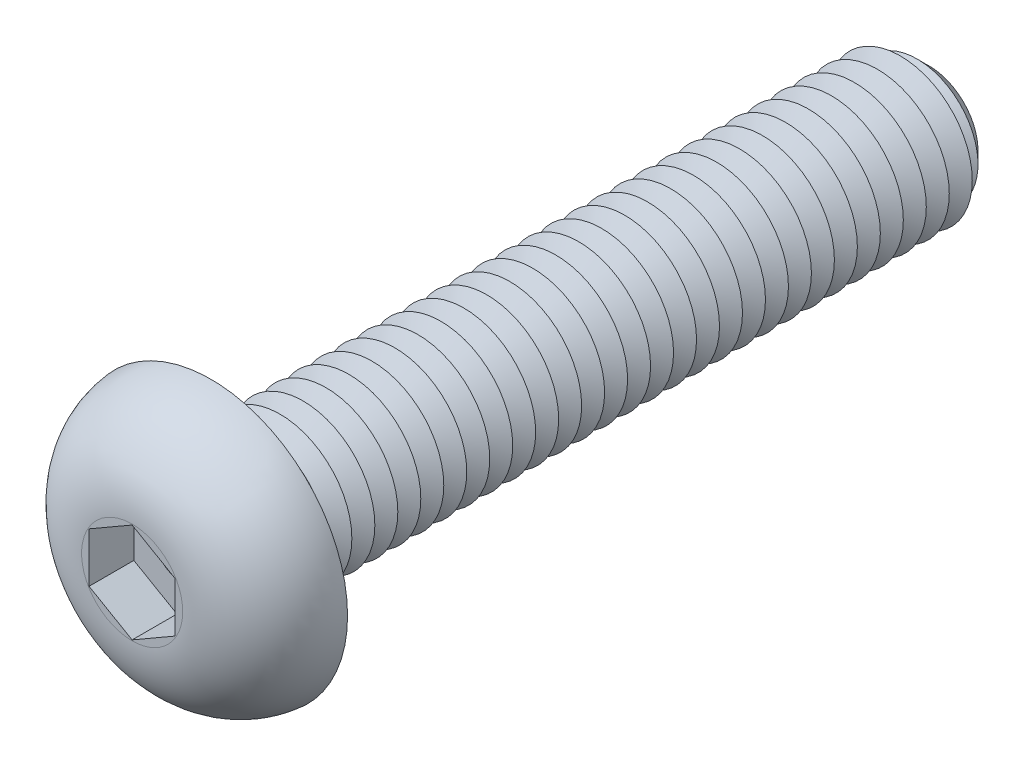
SolidWorks part; units mm, degrees
ref_plane "Front Plane" through (0, 0, 0) normal (0, 0, 1) x (1, 0, 0)
ref_plane "Top Plane" through (0, 0, 0) normal (0, 1, 0) x (1, 0, 0)
ref_plane "Right Plane" through (0, 0, 0) normal (1, 0, 0) x (0, 0, -1)
sketch "Sketch1" plane through (0, 0, 0) normal (1, 0, 0) x (0, 0, -1)
  line L0 (-47.9342, 0) -> (60.3146, 0) construction
sketch "Sketch2" plane through (0, 0, 0) normal (1, 0, 0) x (0, 0, -1)
  line L0 (0, 0) -> (-2.75, 0)
  line L1 (-47.9342, 0) -> (60.3146, 0) construction
  line L2 (-2.75, 0) -> (-2.75, 1.7604)
  line L3 (0, 4.75) -> (0, 0)
  arc A0 (-2.75, 1.7604) -> (0, 4.75) centre (0.25, 1.7604) cw
  dimension "D1" = 3
  dimension "D2" = 2.75
  dimension "D3" = 4.75
revolve "Revolve1" add sketch "Sketch2" angle 360 about L0
sketch "Sketch3" plane through (0, 0, 2.75) normal (0, 0, 1) x (1, 0, 0)
  line L1 (0, 1.7321) -> (-1.5, 0.866)
  line L2 (-1.5, 0.866) -> (-1.5, -0.866)
  line L3 (-1.5, -0.866) -> (0, -1.7321)
  line L4 (0, -1.7321) -> (1.5, -0.866)
  line L5 (1.5, -0.866) -> (1.5, 0.866)
  line L6 (1.5, 0.866) -> (0, 1.7321)
  circle A0 centre (0, 0) radius 1.5 construction
  dimension "D1" = 3
extrude "Cut-Extrude1" cut sketch "Sketch3" against normal blind 1.56
sketch "Sketch4" plane through (0, 0, 0) normal (0, 0, -1) x (-1, 0, 0)
  circle A0 centre (0, 0) radius 2.5
  dimension "D1" = 5
extrude "Boss-Extrude1" add sketch "Sketch4" along normal blind 25
chamfer "Chamfer1" distance 0.8 angle 45 1 edges at (-2.5, 0, -25)
sketch "Sketch5" plane through (0, 0, 0) normal (1, 0, 0) x (0, 0, -1)
  line L0 (0.8, 2.5) -> (1.6, 2.5)
  line L1 (24.2, 2.5) -> (0, 2.5) construction
  line L2 (1.6, 2.5) -> (1.2, 1.8072)
  line L3 (1.2, 1.8072) -> (0.8, 2.5)
  line L4 (0, -4.75) -> (0, 4.75) construction
  line L5 (24.2, 2.5) -> (0, 2.5) construction
  dimension "D1" = 0.8
  dimension "D2" = 0.8
revolve "Cut-Revolve1" cut sketch "Sketch5" angle 360 about L0
pattern_linear "LPattern1" count 30 spacing 0.8 along (0, 0, -1) of "Cut-Revolve1"
fillet "Fillet2" radius 0.4 1 edges at (2.5, 0, 0)
sketch "Sketch6" plane through (0, 0, 1.19) normal (0, 0, 1) x (1, 0, 0)
  circle A0 centre (0, 0) radius 0.65
  dimension "D1" = 1.3
extrude "Cut-Extrude2" cut sketch "Sketch6" against normal up to surface (26.19 mm away)
